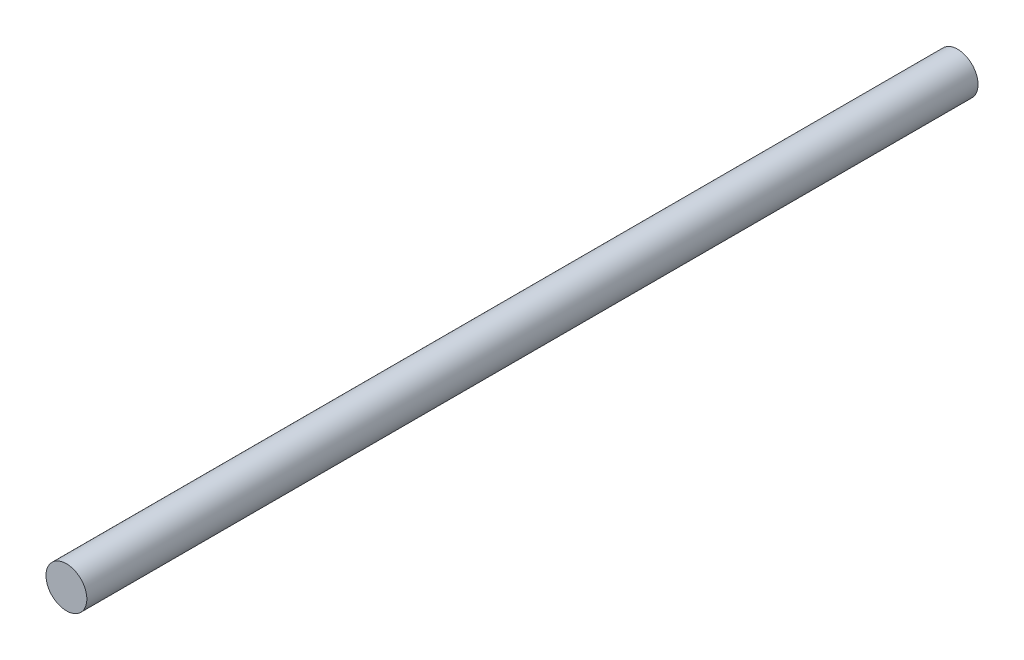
SolidWorks part; units mm, degrees
ref_plane "Plane1" through (0, 0, 0) normal (0, 0, 1) x (1, 0, 0)
ref_plane "Plane2" through (0, 0, 0) normal (0, 1, 0) x (1, 0, 0)
ref_plane "Plane3" through (0, 0, 0) normal (1, 0, 0) x (0, 0, -1)
sketch "Sketch1" plane through (0, 0, 0) normal (0, 0, 1) x (1, 0, 0)
  circle A0 centre (0, 0) radius 18.2626
  dimension "D1" = 36.5252
extrude "Base-Extrude" add sketch "Sketch1" along normal mid plane 796.925
